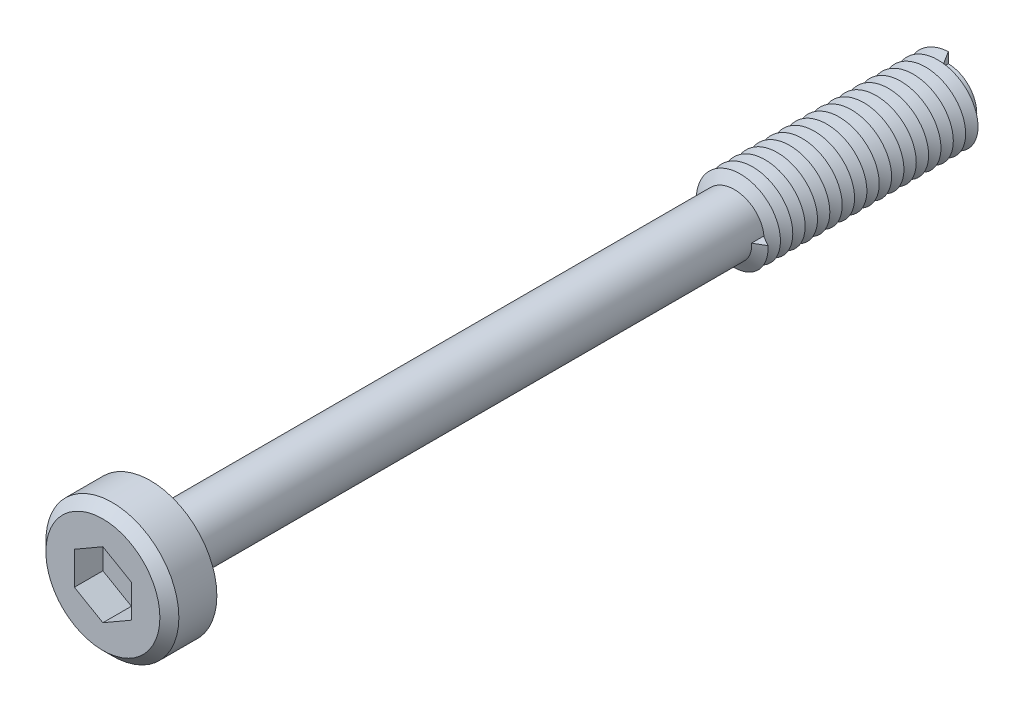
SolidWorks part; units mm, degrees
ref_plane "Front Plane" through (0, 0, 0) normal (0, 0, 1) x (1, 0, 0)
ref_plane "Top Plane" through (0, 0, 0) normal (0, 1, 0) x (1, 0, 0)
ref_plane "Right Plane" through (0, 0, 0) normal (1, 0, 0) x (0, 0, -1)
body saved out of another part "Stock-Ironing Board 2-1"
